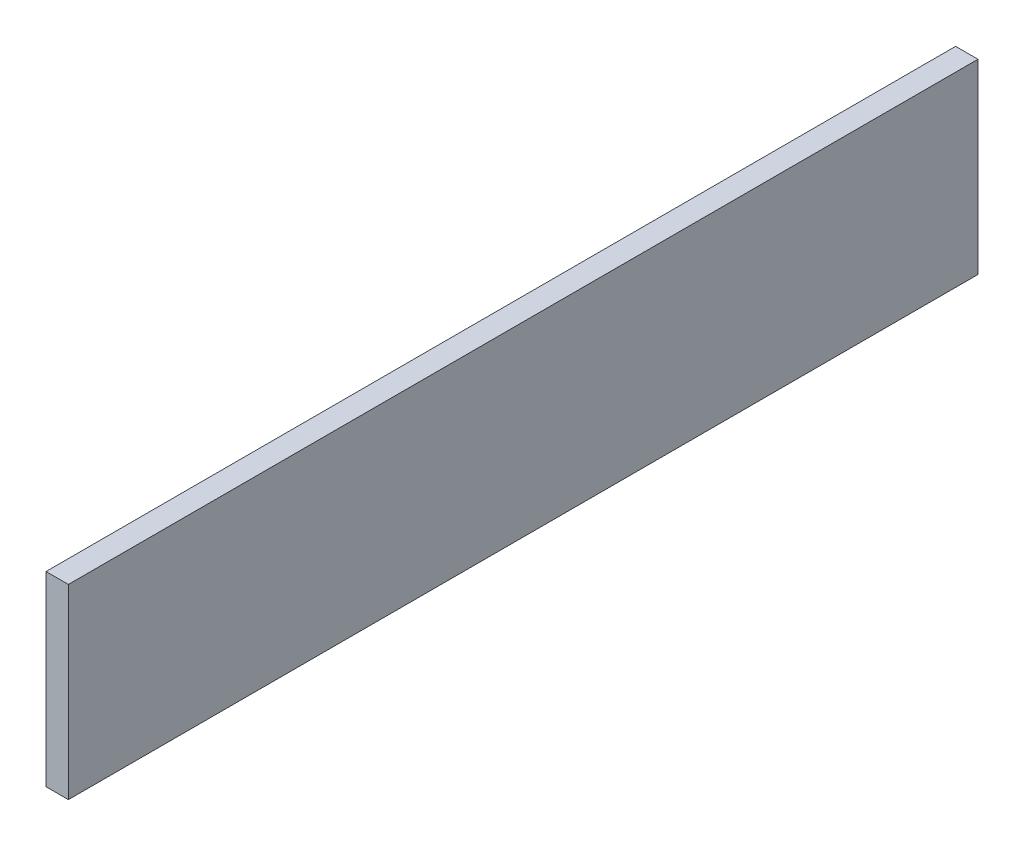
SolidWorks part; units mm, degrees
ref_plane "Front Plane" through (0, 0, 0) normal (0, 0, 1) x (1, 0, 0)
ref_plane "Top Plane" through (0, 0, 0) normal (0, 1, 0) x (1, 0, 0)
ref_plane "Right Plane" through (0, 0, 0) normal (1, 0, 0) x (0, 0, -1)
sketch "Sketch1" plane through (0, 0, 0) normal (1, 0, 0) x (0, 0, -1)
  line L1 (0, 0) -> (123.952, 0)
  line L2 (0, 0) -> (0, 25.4)
  line L3 (0, 25.4) -> (123.952, 25.4)
  line L4 (123.952, 0) -> (123.952, 25.4)
  dimension "D1" = 25.4
  dimension "D2" = 123.952
extrude "Boss-Extrude1" add sketch "Sketch1" along normal blind 3.048
